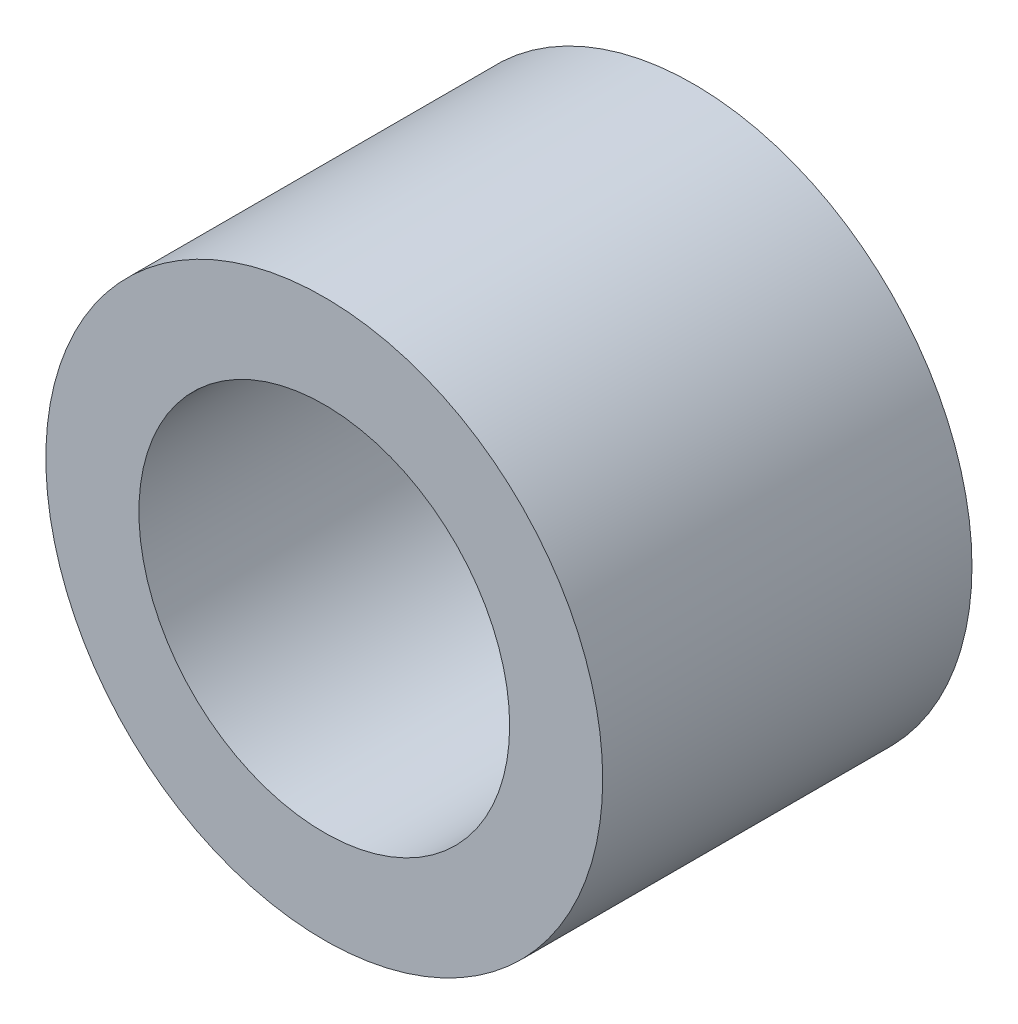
SolidWorks part; units mm, degrees
ref_plane "Front Plane" through (0, 0, 0) normal (0, 0, 1) x (1, 0, 0)
ref_plane "Top Plane" through (0, 0, 0) normal (0, 1, 0) x (1, 0, 0)
ref_plane "Right Plane" through (0, 0, 0) normal (1, 0, 0) x (0, 0, -1)
sketch "Sketch1" plane through (0, 0, 0) normal (0, 0, 1) x (1, 0, 0)
  circle A0 centre (0, 0) radius 4.7879
  circle A1 centre (0, 0) radius 3.1877
  dimension "D1" = 9.5758
  dimension "ID" = 6.3754
extrude "Extrude1" add sketch "Sketch1" along normal mid plane 6.35
sketch "Sketch2" plane through (0, 0, 0) normal (1, 0, 0) x (0, 0, -1)
  line L0 (-3.175, -3.1877) -> (3.175, -3.1877) construction
  line L3 (3.175, 3.1877) -> (-3.175, 3.1877) construction
  line L5 (-3.175, -3.1877) -> (3.175, -3.1877)
  line L6 (3.175, 3.1877) -> (-3.175, 3.1877)
sketch "Sketch4" plane through (0, 0, 3.175) normal (0, 0, 1) x (1, 0, 0)
  line L0 (0, 0) -> (-2.254, 2.254)
  line L1 (0, -13.97) -> (0, 13.97) construction
  circle A0 centre (0, 0) radius 3.1877 construction
  dimension "D1" = 45
